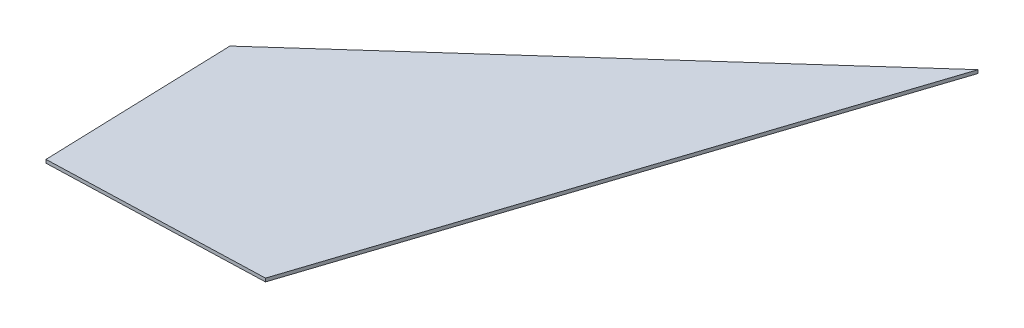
SolidWorks part; units mm, degrees
ref_plane "Front Plane" through (0, 0, 0) normal (0, 0, 1) x (1, 0, 0)
ref_plane "Top Plane" through (0, 0, 0) normal (0, 1, 0) x (1, 0, 0)
ref_plane "Right Plane" through (0, 0, 0) normal (1, 0, 0) x (0, 0, -1)
sketch "Sketch1" plane through (0, 0, 0) normal (0, 1, 0) x (1, 0, 0)
  line L0 (55.849, 77.0109) -> (-55.849, -23.1069)
  line L1 (-54.0884, -77.0109) -> (6.063, -75.0462)
  line L2 (-55.849, -23.1069) -> (-54.0884, -77.0109)
  line L3 (6.063, -75.0462) -> (55.849, 77.0109)
  dimension "D1" = 160
  dimension "D2" = 130
  dimension "D3" = 110
extrude "Boss-Extrude1" add sketch "Sketch1" against normal blind 1
sketch "Sketch2" plane through (0, 0, 0) normal (0, 1, 0) x (-1, 0, 0)
  line L8 (-7.5279, 76.9994) -> (-60.0722, -83.4821)
  line L9 (56.022, 79.0751) -> (-7.5279, 76.9994)
  line L10 (57.8783, 22.2401) -> (56.022, 79.0751)
  line L11 (-60.0722, -83.4821) -> (57.8783, 22.2401)
  line L12 (-7.5279, 76.9994) -> (-60.0722, -83.4821)
  line L13 (56.022, 79.0751) -> (-7.5279, 76.9994)
  line L14 (57.8783, 22.2401) -> (56.022, 79.0751)
  line L15 (-60.0722, -83.4821) -> (57.8783, 22.2401)
  dimension "D1" = 2
extrude "Boss-Extrude2" add sketch "Sketch2" along normal blind 1
